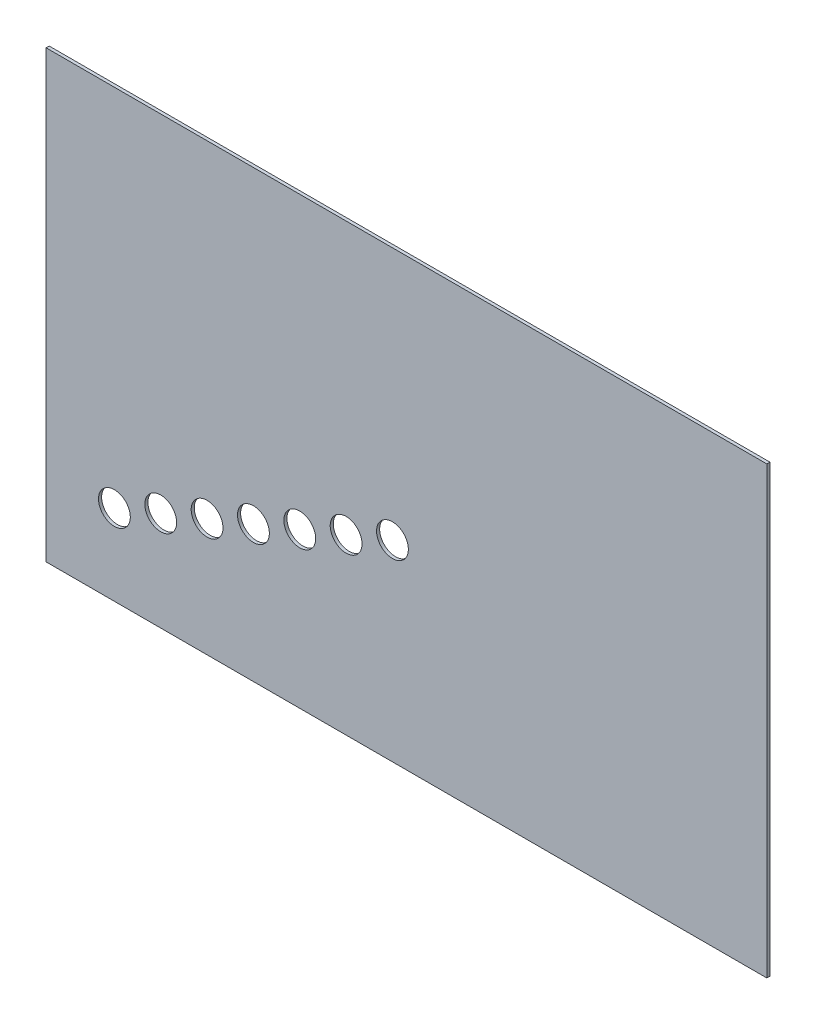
SolidWorks part; units mm, degrees
ref_plane "Ebene vorne" through (0, 0, 0) normal (0, 0, 1) x (1, 0, 0)
ref_plane "Ebene oben" through (0, 0, 0) normal (0, 1, 0) x (1, 0, 0)
ref_plane "Ebene rechts" through (0, 0, 0) normal (1, 0, 0) x (0, 0, -1)
sketch "Skizze1" plane through (0, 0, 0) normal (0, 0, 1) x (1, 0, 0)
  line L1 (-116.6455, 72.0582) -> (116.6455, 72.0582)
  line L2 (-116.6455, 72.0582) -> (-116.6455, -72.0582)
  line L3 (-116.6455, -72.0582) -> (116.6455, -72.0582)
  line L4 (116.6455, 72.0582) -> (116.6455, -72.0582)
  line L5 (-116.6455, 72.0582) -> (116.6455, -72.0582) construction
  line L6 (-116.6455, -72.0582) -> (116.6455, 72.0582) construction
  point P0 (0, 0)
extrude "Aufsatz-Linear austragen1" add sketch "Skizze1" along normal blind 1
sketch "Skizze2" plane through (0, 0, 1) normal (0, 0, 1) x (1, 0, 0)
  circle A0 centre (-94.5329, -45.9034) radius 5.1482
extrude "Schnitt-Linear austragen1" cut sketch "Skizze2" against normal through all
sketch "Skizze3" plane through (0, 0, 1) normal (0, 0, 1) x (1, 0, 0)
  line L0 (-94.5329, -45.9034) -> (-79.5329, -45.9034)
  line L1 (-79.5329, -45.9034) -> (-79.5329, -39.9034)
  line L2 (-79.5329, -39.9034) -> (-94.5329, -45.9034)
  dimension "D1" = 15
  dimension "D2" = 6
  dimension "D3" = 16.1555
pattern_linear "Lineares Muster2" count 7 spacing 16.1555 along (0.9285, 0.3714, 0) of "Schnitt-Linear austragen1"
equation "\"Musterlänge\"= \"D3@Skizze3\""
